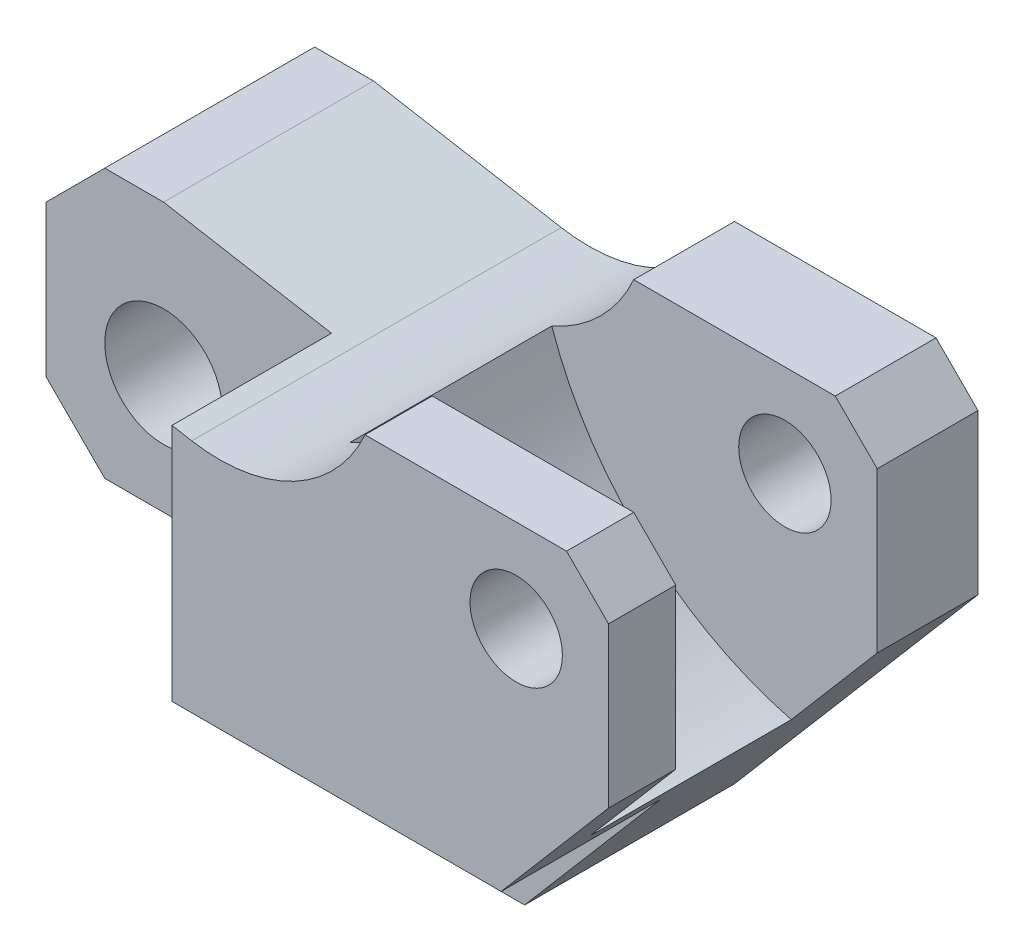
SolidWorks part; units mm, degrees
ref_plane "Front Plane" through (0, 0, 0) normal (0, 0, 1) x (1, 0, 0)
ref_plane "Top Plane" through (0, 0, 0) normal (0, 1, 0) x (1, 0, 0)
ref_plane "Right Plane" through (0, 0, 0) normal (1, 0, 0) x (0, 0, -1)
sketch "Esquisse1" plane through (0, 0, 0) normal (0, 0, 1) x (1, 0, 0)
  line L0 (0.1394, 21.4139) -> (24.1394, 21.4139)
  line L1 (24.1394, 21.4139) -> (29.1394, 16.4139)
  line L2 (29.1394, 16.4139) -> (29.1394, -2.5861)
  line L3 (29.1394, -2.5861) -> (0.1394, -36.5861)
  line L4 (0.1394, -36.5861) -> (-5.5636, -36.5861)
  line L5 (-17.285, -17.5861) -> (-49.8606, -17.5861)
  line L6 (-49.8606, -17.5861) -> (-56.8606, -10.5861)
  line L7 (-56.8606, -10.5861) -> (-56.8606, 7.4139)
  line L8 (-56.8606, 7.4139) -> (-49.8606, 14.4139)
  line L9 (-49.8606, 14.4139) -> (-42.8606, 14.4139)
  line L10 (-42.8606, 14.4139) -> (-20.4992, 10.471)
  arc A0 (-5.5636, -36.5861) -> (-12.3394, -21.8508) centre (16.3453, -17.5861) cw
  arc A1 (-12.3394, -21.8508) -> (-17.285, -17.5861) centre (-17.285, -22.5861) ccw
  arc A2 (-20.4992, 10.471) -> (0.1394, 21.4139) centre (-17.1999, 29.1823) ccw
  circle A3 centre (-42.8606, -3.5861) radius 7
  point P19 (-39.8889, -6.3842)
  point P20 (-33.0455, 26.0588)
  point P21 (-20.4992, 10.471)
  dimension "D5" = 29
  dimension "D15" = 5
  dimension "D19" = 19
  dimension "D20" = 14
  dimension "D1" = 29
  dimension "D2" = 135
  dimension "D3" = 5
  dimension "D4" = 24
  dimension "D6" = 19
  dimension "D7" = 29
  dimension "D8" = 86
  dimension "D9" = 7
  dimension "D10" = 32
  dimension "D11" = 135
  dimension "D12" = 7
  dimension "D13" = 14
  dimension "D14" = 190
  dimension "D16" = 58
  dimension "D17" = 14
  dimension "D18" = 14
  dimension "D21" = 19
  dimension "D22" = 135
extrude "Boss.-Extru.1" add sketch "Esquisse1" along normal blind 44
ref_plane "Plan1" through (0, 0, 12) normal (0, 0, -1) x (-1, 0, 0)
sketch "Esquisse4" plane through (0, 0, 12) normal (0, 0, -1) x (-1, 0, 0)
  line L11 (-0.1394, 21.4139) -> (-24.1394, 21.4139)
  line L12 (-24.1394, 21.4139) -> (-29.1394, 16.4139)
  line L13 (-29.1394, 16.4139) -> (-29.1394, -2.5861)
  line L14 (-29.1394, -2.5861) -> (-0.1394, -36.5861)
  line L15 (-0.1394, -36.5861) -> (5.5636, -36.5861)
  line L16 (17.285, -17.5861) -> (49.8606, -17.5861)
  line L17 (49.8606, -17.5861) -> (56.8606, -10.5861)
  line L18 (56.8606, -10.5861) -> (56.8606, 7.4139)
  line L19 (56.8606, 7.4139) -> (49.8606, 14.4139)
  line L20 (49.8606, 14.4139) -> (42.8606, 14.4139)
  line L21 (42.8606, 14.4139) -> (20.4992, 10.471)
  line L22 (-0.1394, 21.4139) -> (-24.1394, 21.4139)
  line L23 (-24.1394, 21.4139) -> (-29.1394, 16.4139)
  line L24 (-29.1394, 16.4139) -> (-29.1394, -2.5861)
  line L25 (-29.1394, -2.5861) -> (-18.9041, -14.5861)
  arc A0 (-18.9041, -14.5861) -> (9.6236, 11.7582) centre (-29.1394, 25.1158) ccw
  arc A4 (-0.1394, 21.4139) -> (20.4992, 10.471) centre (17.1999, 29.1823) ccw
  arc A5 (5.5636, -36.5861) -> (12.3394, -21.8508) centre (-16.3453, -17.5861) ccw
  arc A6 (17.285, -17.5861) -> (12.3394, -21.8508) centre (17.285, -22.5861) ccw
  arc A7 (-0.1394, 21.4139) -> (9.6236, 11.7582) centre (17.1999, 29.1823) ccw
  dimension "D1" = 41
  dimension "D3" = 36
  dimension "D2" = 0
extrude "Enlèv. mat.-Extru.3" cut sketch "Esquisse4" against normal blind 24
sketch "Esquisse5" plane through (0, 0, 44) normal (0, 0, 1) x (1, 0, 0)
  line L0 (-17.285, -17.5861) -> (16.3453, -17.5861)
  line L5 (-22.8606, -17.5861) -> (-22.8606, 10.8873)
  line L12 (-20.4992, 10.471) -> (-42.8606, 14.4139)
  line L13 (-42.8606, 14.4139) -> (-49.8606, 14.4139)
  line L14 (-49.8606, 14.4139) -> (-56.8606, 7.4139)
  line L15 (-56.8606, 7.4139) -> (-56.8606, -10.5861)
  line L16 (-56.8606, -10.5861) -> (-49.8606, -17.5861)
  line L17 (-49.8606, -17.5861) -> (-17.285, -17.5861)
  line L18 (-5.5636, -36.5861) -> (0.1394, -36.5861)
  line L19 (0.1394, -36.5861) -> (29.1394, -2.5861)
  line L20 (29.1394, -2.5861) -> (29.1394, 16.4139)
  line L21 (29.1394, 16.4139) -> (24.1394, 21.4139)
  line L22 (24.1394, 21.4139) -> (0.1394, 21.4139)
  line L23 (-22.8606, 10.8873) -> (-42.8606, 14.4139)
  line L24 (-42.8606, 14.4139) -> (-49.8606, 14.4139)
  line L25 (-49.8606, 14.4139) -> (-56.8606, 7.4139)
  line L26 (-56.8606, 7.4139) -> (-56.8606, -10.5861)
  line L27 (-56.8606, -10.5861) -> (-49.8606, -17.5861)
  line L28 (-49.8606, -17.5861) -> (-22.8606, -17.5861)
  line L29 (-5.5636, -36.5861) -> (0.1394, -36.5861)
  line L30 (0.1394, -36.5861) -> (16.3453, -17.5861)
  arc A4 (-20.4992, 10.471) -> (0.1394, 21.4139) centre (-17.1999, 29.1823) ccw
  arc A5 (-12.3394, -21.8508) -> (-17.285, -17.5861) centre (-17.285, -22.5861) ccw
  arc A6 (-12.3394, -21.8508) -> (-5.5636, -36.5861) centre (16.3453, -17.5861) ccw
  arc A8 (-12.3394, -21.8508) -> (-17.285, -17.5861) centre (-17.285, -22.5861) ccw
  arc A9 (-12.3394, -21.8508) -> (-5.5636, -36.5861) centre (16.3453, -17.5861) ccw
  dimension "D1" = 52
  dimension "D2" = 0
extrude "Enlèv. mat.-Extru.6" cut sketch "Esquisse5" against normal blind 19
sketch "Esquisse6" plane through (0, 0, 44) normal (0, 0, 1) x (1, 0, 0)
  line L0 (24.1394, 21.4139) -> (0.1394, 21.4139) construction
  line L1 (29.1394, -2.5861) -> (29.1394, 16.4139) construction
  circle A0 centre (18.1394, 10.4139) radius 5.5
  dimension "D1" = 11
  dimension "D2" = 11
  dimension "D3" = 11
extrude "Enlèv. mat.-Extru.7" cut sketch "Esquisse6" against normal blind 73
